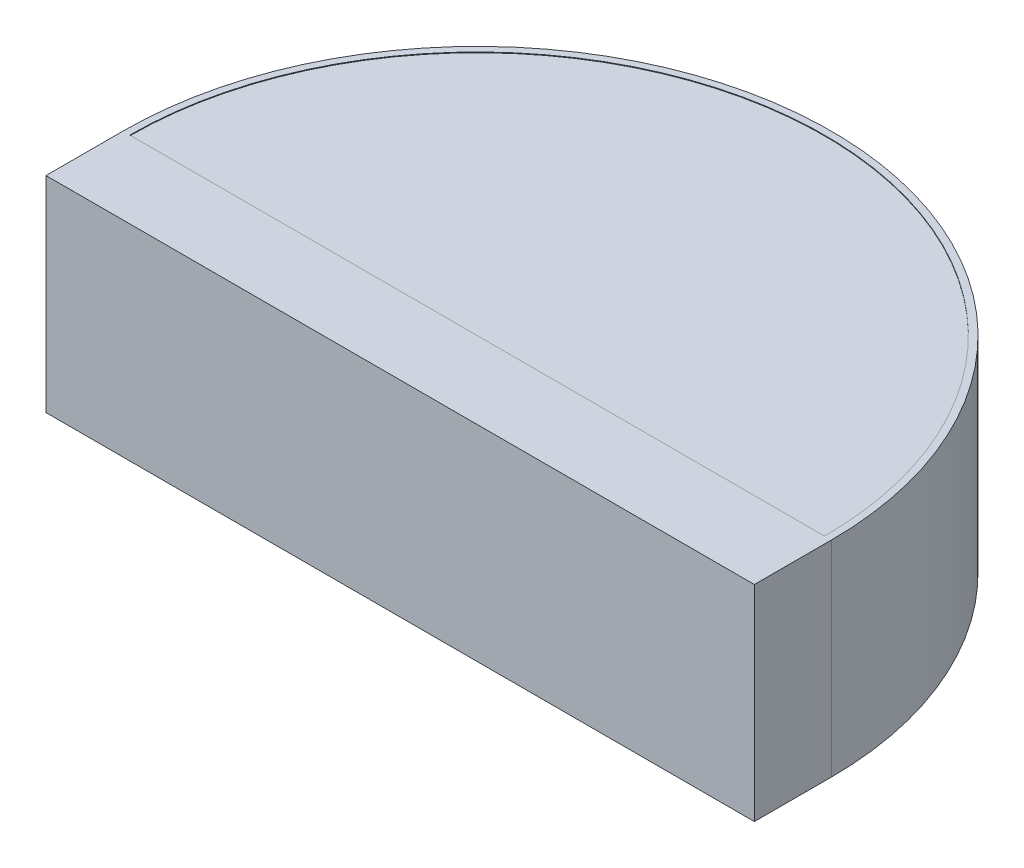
SolidWorks part; units mm, degrees
ref_plane "Alzado" through (0, 0, 0) normal (0, 0, 1) x (1, 0, 0)
ref_plane "Planta" through (0, 0, 0) normal (0, 1, 0) x (1, 0, 0)
ref_plane "Vista lateral" through (0, 0, 0) normal (1, 0, 0) x (0, 0, -1)
sketch "Croquis1" plane through (0, 0, 0) normal (0, 1, 0) x (1, 0, 0)
  line L0 (103.5, 0) -> (-103.5, 0)
  line L1 (0, 0) -> (0, 126) construction
  line L2 (-103.5, 0) -> (-103.5, 22.5)
  line L4 (103.5, 22.5) -> (103.5, 0)
  arc A0 (103.5, 22.5) -> (-103.5, 22.5) centre (0, 22.5) ccw
  point P4 (0, 0)
  dimension "D2" = 126
  dimension "D1" = 207
extrude "Saliente-Extruir1" add sketch "Croquis1" along normal blind 60
sketch "Croquis2" plane through (0, 60, 0) normal (0, 1, 0) x (1, 0, 0)
  line L3 (-101.5, 22.5) -> (101.5, 22.5)
  arc A3 (101.5, 22.5) -> (-101.5, 22.5) centre (0, 22.5) ccw
  arc A4 (101.5, 22.5) -> (-101.5, 22.5) centre (0, 22.5) ccw
  dimension "D1" = 2
extrude "Cortar-Extruir1" cut sketch "Croquis2" against normal blind 0.2
sketch "Croquis3" plane through (0, 0, 0) normal (0, -1, 0) x (1, 0, 0)
  line L0 (-101.5, -22.5) -> (101.5, -22.5)
  arc A2 (-101.5, -22.5) -> (101.5, -22.5) centre (0, -22.5) ccw
  arc A3 (-101.5, -22.5) -> (101.5, -22.5) centre (0, -22.5) ccw
  dimension "D1" = 2
extrude "Cortar-Extruir2" cut sketch "Croquis3" against normal blind 0.2
